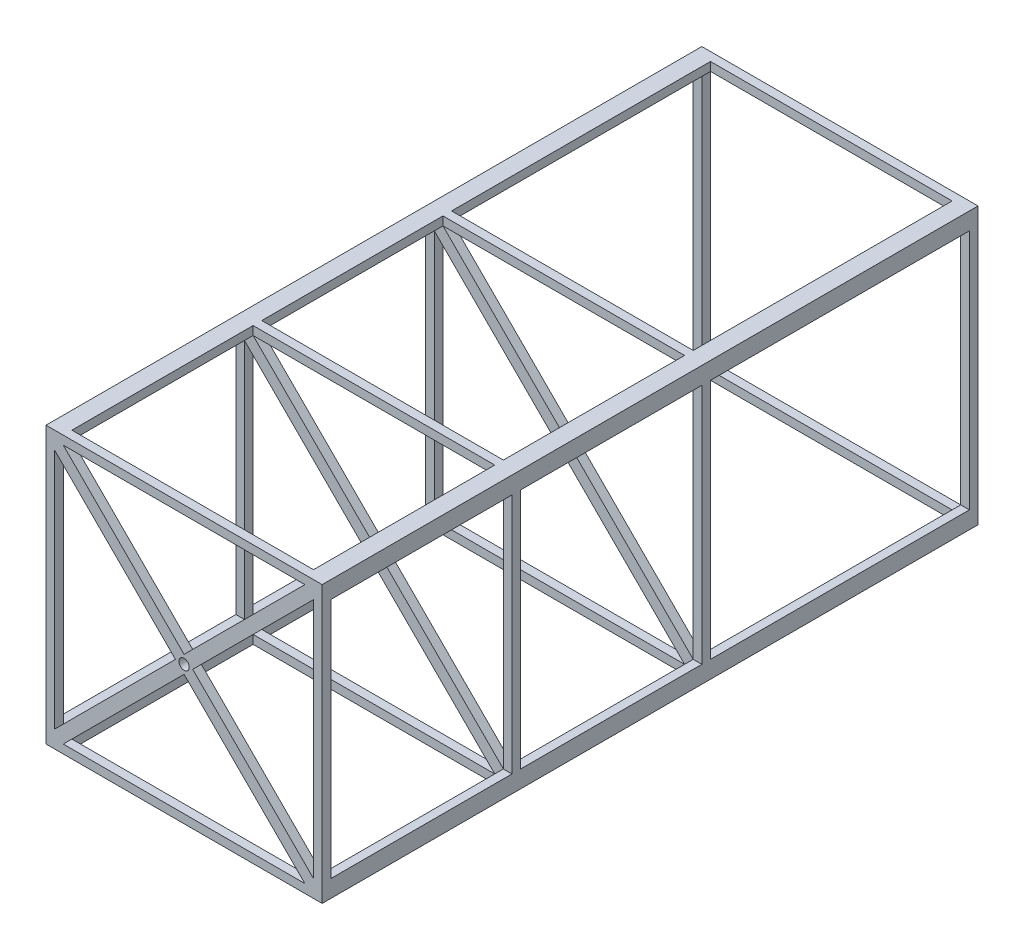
SolidWorks part; units mm, degrees
ref_plane "Front Plane" through (0, 0, 0) normal (0, 0, 1) x (1, 0, 0)
ref_plane "Top Plane" through (0, 0, 0) normal (0, 1, 0) x (1, 0, 0)
ref_plane "Right Plane" through (0, 0, 0) normal (1, 0, 0) x (0, 0, -1)
sketch "Sketch1" plane through (0, 0, 0) normal (0, 0, 1) x (1, 0, 0)
  line L0 (0, 0) -> (0, 160)
  line L1 (0, 160) -> (160, 160)
  line L2 (160, 160) -> (160, 0)
  line L3 (160, 0) -> (0, 0)
  line L4 (5, 160) -> (5, 0)
  line L5 (0, 155) -> (160, 155)
  line L6 (160, 5) -> (0, 5)
  line L7 (155, 0) -> (155, 160)
  line L8 (0, 155) -> (155, 0)
  line L9 (160, 5) -> (5, 160)
  line L10 (155, 160) -> (0, 5)
  line L11 (160, 155) -> (5, 0)
  dimension "D1" = 5
  dimension "D2" = 5
  dimension "D3" = 5
  dimension "D4" = 5
  dimension "D5" = 160
  dimension "D6" = 160
extrude "Boss-Extrude1" add sketch "Sketch1" along normal blind 5 from offset 105 contours L0 L5 L4 L1 | L5 L9 L4 | L10 L1 L9 L5 | L7 L10 L5 | L11 L5 L7 | L2 L11 L7 L9 | L7 L5 L2 L1 | L6 L9 L7 | L6 L8 L7 | L7 L3 L2 L6 | L9 L11 L8 L6 L7 | L6 L11 L3 L8 | L4 L6 L0 L3 | L11 L6 L4 | L4 L10 L6 | L11 L8 L10 L4 L6 | L10 L4 L8 L0 | L5 L8 L4 | L10 L9 L5 L4 L8 | L11 L7 L5 L10 L9 | L11 L9 L10 L8
pattern_linear "LPattern1" count 3 spacing 110 along (0, 0, 1) of "Boss-Extrude1"
sketch "Sketch8" plane through (0, 0, 330) normal (0, 0, 1) x (1, 0, 0)
  line L0 (0, 160) -> (0, 150)
  line L1 (0, 0) -> (0, 160) construction
  line L2 (0, 150) -> (5, 150)
  line L3 (5, 150) -> (10, 155)
  line L4 (10, 155) -> (10, 160)
  line L5 (0, 160) -> (160, 160) construction
  line L6 (10, 160) -> (0, 160)
  line L7 (10, 5) -> (10, 0)
  line L8 (160, 0) -> (0, 0) construction
  line L9 (10, 0) -> (0, 0)
  line L10 (0, 0) -> (0, 10)
  line L11 (0, 10) -> (5, 10)
  line L12 (5, 10) -> (10, 5)
  line L13 (150, 5) -> (155, 10)
  line L14 (155, 10) -> (160, 10)
  line L15 (160, 160) -> (160, 0) construction
  line L16 (160, 10) -> (160, 0)
  line L17 (160, 0) -> (150, 0)
  line L18 (150, 0) -> (150, 5)
  line L19 (160, 160) -> (150, 160)
  line L20 (150, 160) -> (150, 155)
  line L21 (150, 155) -> (155, 150)
  line L22 (155, 150) -> (160, 150)
  line L23 (160, 150) -> (160, 160)
extrude "Boss-Extrude8" add sketch "Sketch8" against normal blind 375
sketch "Sketch9" plane through (0, 0, -45) normal (0, 0, -1) x (-1, 0, 0)
  line L0 (-155, 150) -> (-150, 155)
  line L1 (-150, 155) -> (-10, 155)
  line L2 (-10, 155) -> (-5, 150)
  line L3 (-5, 150) -> (-5, 10)
  line L4 (-5, 10) -> (-10, 5)
  line L5 (-10, 5) -> (-150, 5)
  line L6 (-150, 5) -> (-155, 10)
  line L7 (-155, 10) -> (-155, 150)
  line L8 (-160, 160) -> (-160, 0)
  line L9 (-160, 0) -> (0, 0)
  line L10 (0, 0) -> (0, 160)
  line L11 (0, 160) -> (-160, 160)
extrude "Boss-Extrude9" add sketch "Sketch9" along normal blind 5
sketch "Sketch10" plane through (0, 0, 105) normal (0, 0, -1) x (-1, 0, 0)
  line L0 (-80, 85) -> (-80, 75) construction
  circle A0 centre (-80, 80) radius 3
extrude "Cut-Extrude2" cut sketch "Sketch10" against normal through all both and the other way through all
